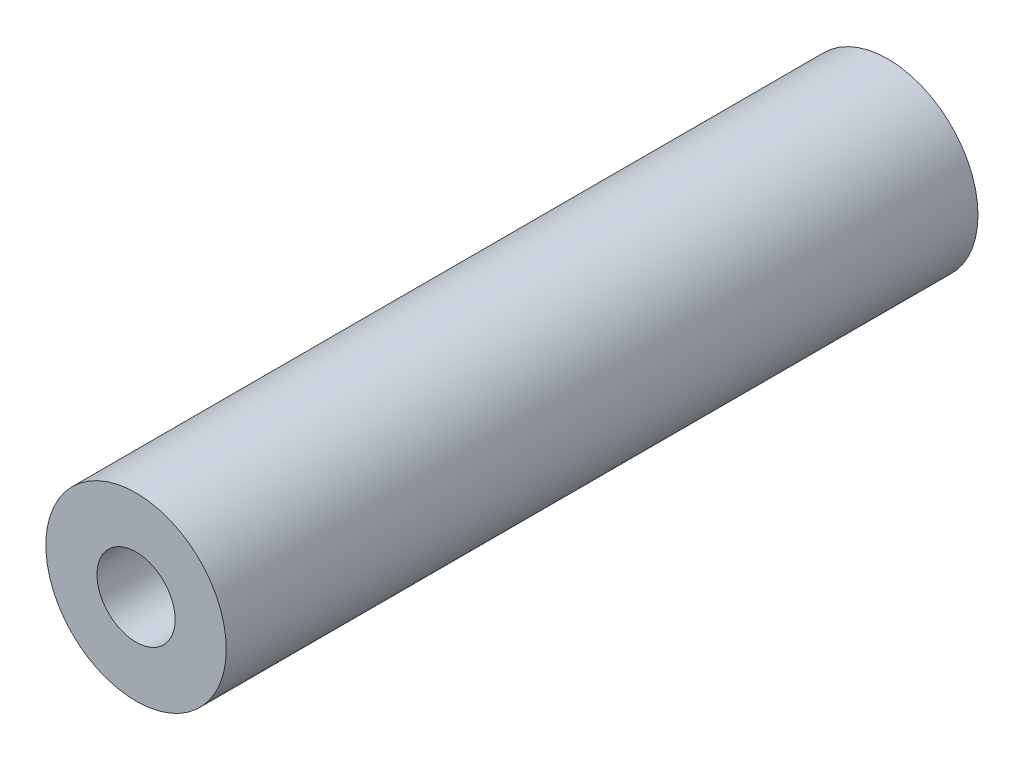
SolidWorks part; units mm, degrees
ref_plane "Plan de face" through (0, 0, 0) normal (0, 0, 1) x (1, 0, 0)
ref_plane "Plan de dessus" through (0, 0, 0) normal (0, 1, 0) x (1, 0, 0)
ref_plane "Plan de droite" through (0, 0, 0) normal (1, 0, 0) x (0, 0, -1)
sketch "Esquisse1" plane through (0, 0, 0) normal (0, 1, 0) x (1, 0, 0)
  line L0 (2.6, 13) -> (0, 13)
  line L1 (0, 13) -> (0, -13)
  line L2 (0, -13) -> (2.6, -13)
  line L3 (2.6, -13) -> (2.6, -25)
  line L4 (2.6, -25) -> (6, -25)
  line L5 (6, -25) -> (6, 25)
  line L6 (6, 25) -> (2.6, 25)
  line L7 (2.6, 25) -> (2.6, 13)
  line L8 (0, 25) -> (0, -25) construction
revolve "Révolution1" add sketch "Esquisse1" angle 360 about L8
